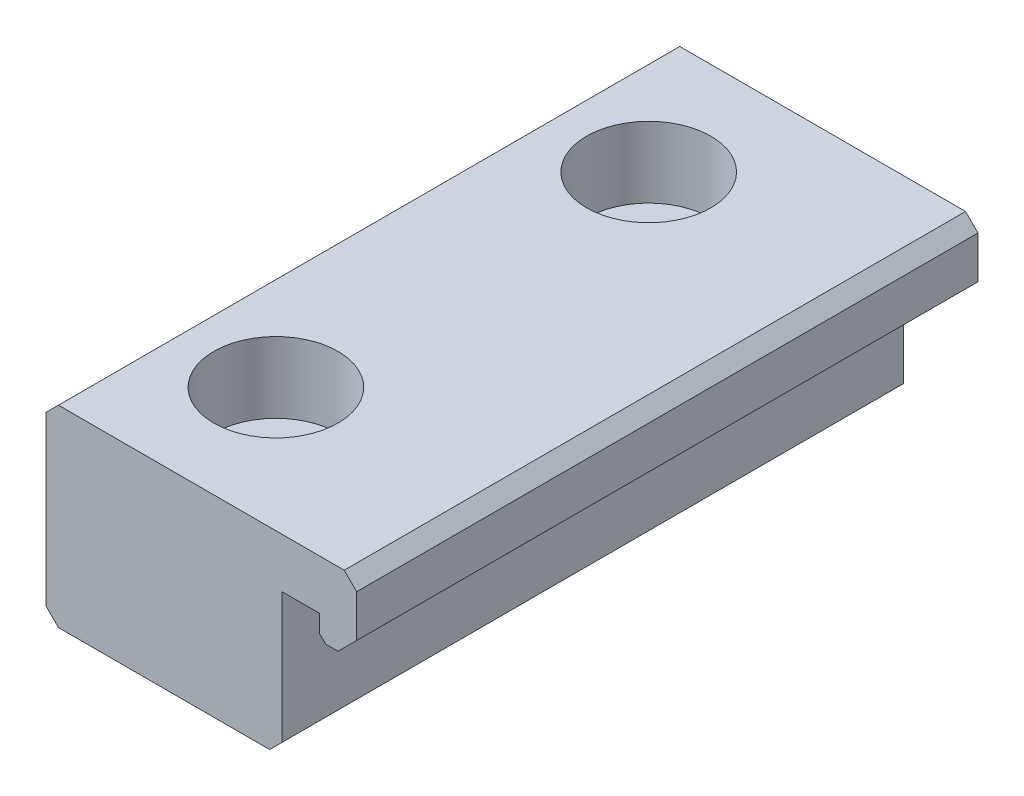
SolidWorks part; units mm, degrees
ref_plane "前视基准面" through (0, 0, 0) normal (0, 0, 1) x (1, 0, 0)
ref_plane "上视基准面" through (0, 0, 0) normal (0, 1, 0) x (1, 0, 0)
ref_plane "右视基准面" through (0, 0, 0) normal (1, 0, 0) x (0, 0, -1)
sketch "草图1" plane through (0, 0, 0) normal (0, 0, 1) x (1, 0, 0)
  line L1 (12.5, 9.6) -> (15.5, 9.6)
  line L3 (15.5, 9.6) -> (15.5, 15.5)
  line L5 (15.5, 15.5) -> (-9.5, 15.5)
  line L7 (-9.5, 15.5) -> (-9.5, 0)
  line L9 (-9.5, 0) -> (9.5, 0)
  line L11 (9.5, 0) -> (9.5, 11.5)
  line L12 (9.5, 11.5) -> (12.5, 11.5)
  line L13 (12.5, 11.5) -> (12.5, 9.6)
  dimension "D1" = 19
  dimension "D2" = 15.5
  dimension "D3" = 11.5
  dimension "D4" = 5.9
  dimension "D5" = 3
  dimension "D6" = 25
extrude "凸台-拉伸1" add sketch "草图1" along normal blind 50
chamfer "倒角1" distance 1 angle 45 4 edges at (15.5, 15.5, 25) (-9.5, 15.5, 25) (-9.5, 0, 25) (9.5, 0, 25)
chamfer "倒角2" distance 0.5 angle 45 1 edges at (12.5, 9.6, 25)
chamfer "倒角3" distance 1.5 angle 45 1 edges at (15.5, 9.6, 25)
hole_wizard "打孔尺寸(%根据)内六角圆柱头螺钉的类型1" positions "草图2" profile "草图3" counterbore size "M5" standard "GB"
sketch "草图2" plane through (0, 15.5, 0) normal (0, 1, 0) x (1, 0, 0)
  line L0 (-9.5, -25) -> (19.5264, -25) construction
  line L1 (-9.5, -50) -> (-9.5, 0) construction
  point P0 (-1, -10)
  point P2 (-1, -40)
  dimension "D1" = 30
  dimension "D2" = 8.5
sketch "草图3" plane through (-1, 15.5, 10) normal (1, 0, 0) x (0, 0, 1)
  line L0 (0, 0) -> (0, 15.5)
  line L1 (0, 15.5) -> (2.75, 15.5)
  line L3 (2.75, 15.5) -> (2.75, 5.7)
  line L4 (2.75, 5.7) -> (5, 5.7)
  line L5 (5, 5.7) -> (5, 0)
  line L7 (5, 0) -> (0, 0)
  line L11 (0, -6.35) -> (0, 107.95) construction
  dimension "通孔孔直径" = 5.5
  dimension "通孔孔深度" = 15.5
  dimension "柱形沉头孔直径" = 10
  dimension "柱形沉头孔深度" = 5.7
other "冻结***"
